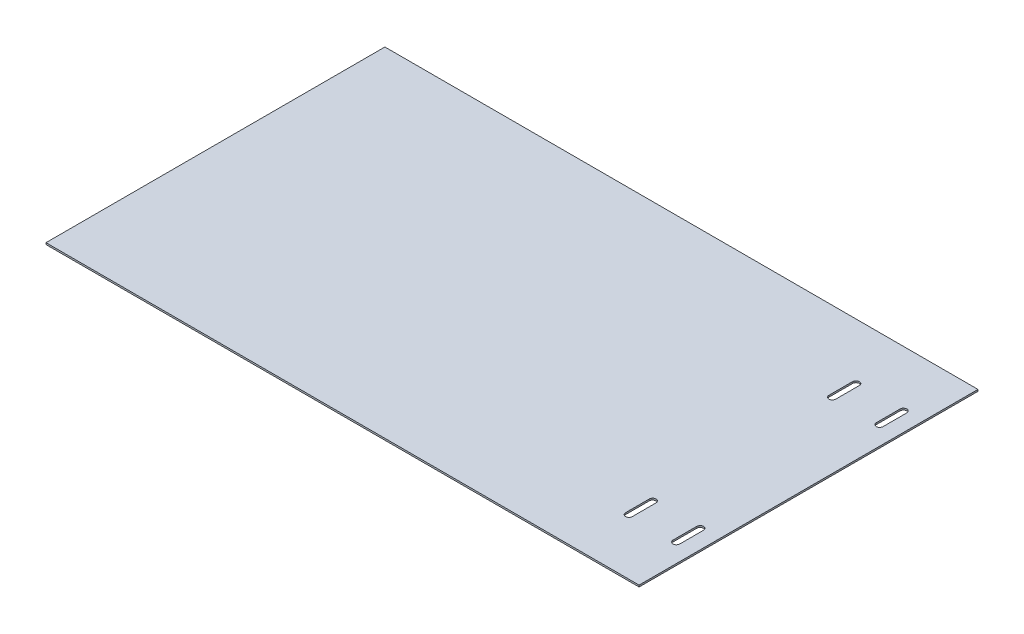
SolidWorks part; units mm, degrees
ref_plane "Front Plane" through (0, 0, 0) normal (0, 0, 1) x (1, 0, 0)
ref_plane "Top Plane" through (0, 0, 0) normal (0, 1, 0) x (1, 0, 0)
ref_plane "Right Plane" through (0, 0, 0) normal (1, 0, 0) x (0, 0, -1)
sketch "Sketch1" plane through (0, 0, 0) normal (0, 1, 0) x (1, 0, 0)
  line L0 (176.1193, 100) -> (-173.8807, 100)
  line L1 (-173.8807, 100) -> (-173.8807, -100)
  line L2 (-173.8807, -100) -> (176.1193, -100)
  line L3 (176.1193, -100) -> (176.1193, 100)
  point P4 (-173.8807, 0)
  dimension "D1" = 200
  dimension "D2" = 350
extrude "Boss-Extrude1" add sketch "Sketch1" along normal blind 1
ref_plane "Plane1" through (0, 0, 0) normal (0, 0, 1) x (1, 0, 0)
sketch "Sketch2" plane through (0, 1, 0) normal (0, 1, 0) x (1, 0, 0)
  line L0 (-173.8807, 100) -> (-134.8807, 100) construction
  line L1 (176.1193, 100) -> (-173.8807, 100) construction
  line L2 (176.1193, -100) -> (176.1193, 100) construction
  line L3 (167.1193, -67) -> (167.1193, -53)
  line L6 (163.1193, -67) -> (163.1193, -53)
  line L7 (139.1193, -67) -> (139.1193, -53)
  line L10 (-173.8807, 0) -> (-158.7503, 0) construction
  line L11 (-173.8807, 100) -> (-173.8807, -100) construction
  line L12 (-69.7514, 0) -> (69.7514, 0) construction
  line L17 (135.1193, -67) -> (135.1193, -53)
  line L22 (135.1193, 67) -> (135.1193, 53)
  line L23 (139.1193, 67) -> (139.1193, 53)
  line L24 (163.1193, 67) -> (163.1193, 53)
  line L25 (167.1193, 67) -> (167.1193, 53)
  arc A12 (139.1193, 53) -> (135.1193, 53) centre (137.1193, 53) cw
  arc A13 (135.1193, 67) -> (139.1193, 67) centre (137.1193, 67) cw
  arc A14 (167.1193, 67) -> (163.1193, 67) centre (165.1193, 67) ccw
  arc A15 (163.1193, 53) -> (167.1193, 53) centre (165.1193, 53) ccw
  arc A16 (163.1193, -53) -> (167.1193, -53) centre (165.1193, -53) cw
  arc A17 (167.1193, -67) -> (163.1193, -67) centre (165.1193, -67) cw
  arc A18 (135.1193, -67) -> (139.1193, -67) centre (137.1193, -67) ccw
  arc A19 (139.1193, -53) -> (135.1193, -53) centre (137.1193, -53) ccw
  dimension "D1" = 28
  dimension "D2" = 39
extrude "Cut-Extrude1" cut sketch "Sketch2" against normal through all
